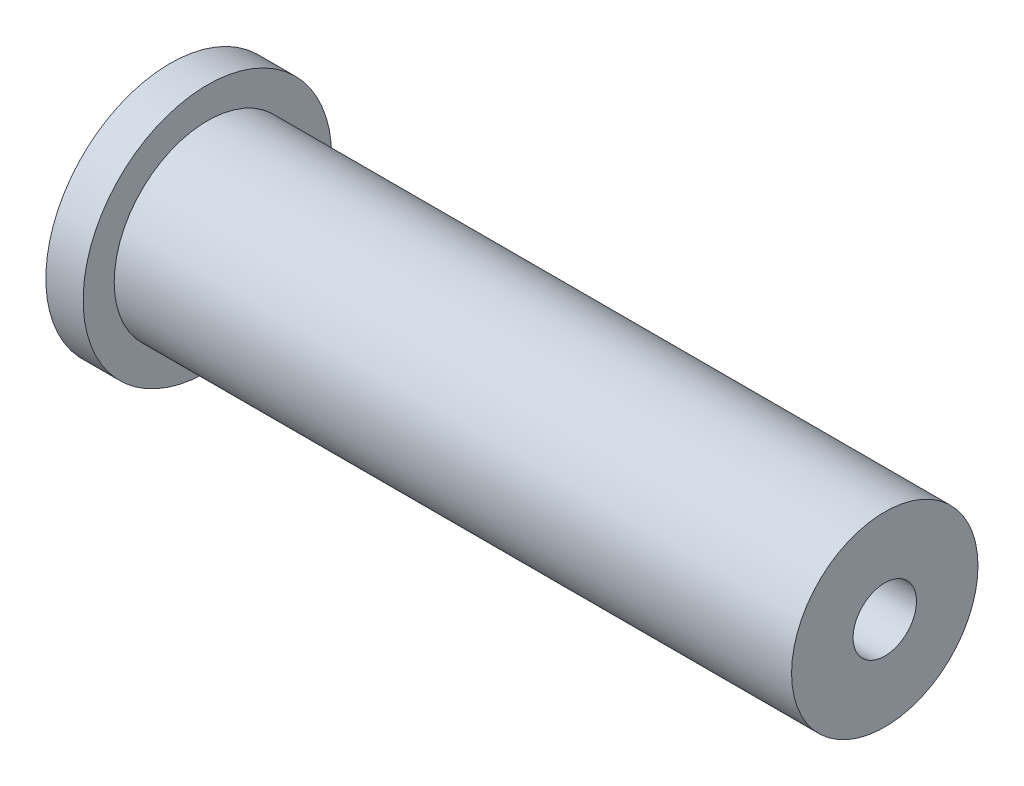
SolidWorks part; units mm, degrees
ref_plane "Front Plane" through (0, 0, 0) normal (0, 0, 1) x (1, 0, 0)
ref_plane "Top Plane" through (0, 0, 0) normal (0, 1, 0) x (1, 0, 0)
ref_plane "Right Plane" through (0, 0, 0) normal (1, 0, 0) x (0, 0, -1)
sketch "Sketch1" plane through (0, 0, 0) normal (0, 0, 1) x (1, 0, 0)
  line L0 (0, 0) -> (0, 10)
  line L1 (0, 10) -> (3, 10)
  line L2 (3, 10) -> (3, 7.5)
  line L3 (3, 7.5) -> (57.5, 7.5)
  line L4 (57.5, 7.5) -> (57.5, 0)
  line L5 (57.5, 0) -> (0, 0)
  line L6 (0, 0) -> (-5.4432, 0) construction
  dimension "D1" = 54.5
  dimension "D2" = 3
  dimension "D3" = 15
  dimension "D4" = 20
revolve "Revolve1" add sketch "Sketch1" angle 360 about L6
sketch "Sketch2" plane through (57.5, 0, 0) normal (1, 0, 0) x (0, 0, -1)
  circle A0 centre (0, 0) radius 2.55
  dimension "D1" = 5.1
extrude "Cut-Extrude1" cut sketch "Sketch2" against normal blind 10
